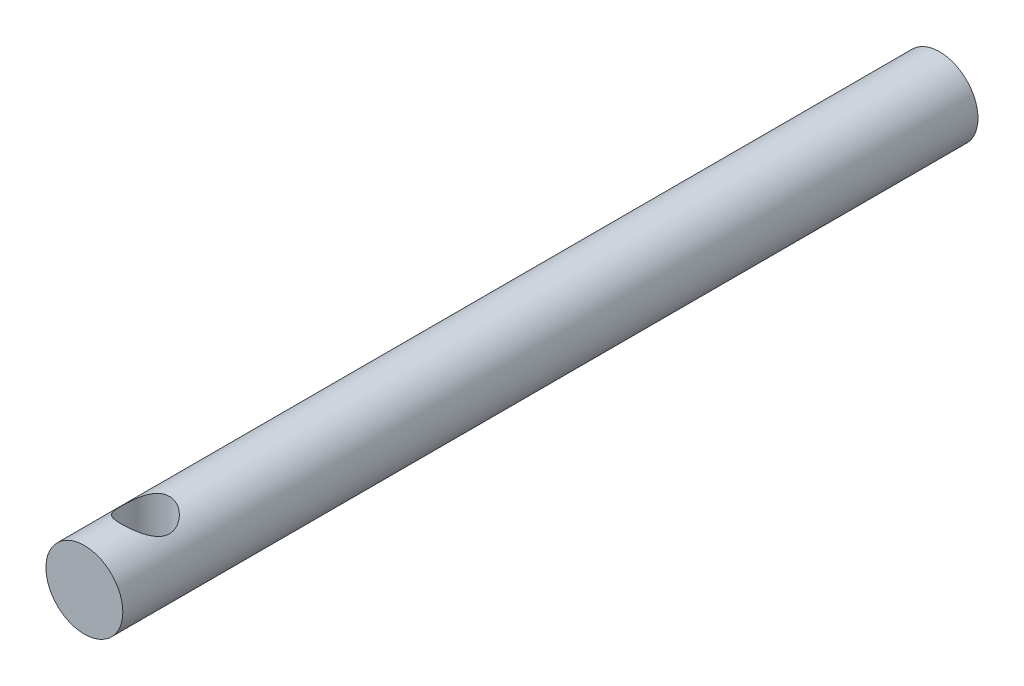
SolidWorks part; units mm, degrees
ref_plane "Front Plane" through (0, 0, 0) normal (0, 0, 1) x (1, 0, 0)
ref_plane "Top Plane" through (0, 0, 0) normal (0, 1, 0) x (1, 0, 0)
ref_plane "Right Plane" through (0, 0, 0) normal (1, 0, 0) x (0, 0, -1)
sketch "Sketch1" plane through (0, 0, 0) normal (0, 0, 1) x (1, 0, 0)
  circle A0 centre (0, 0) radius 4
  dimension "D1" = 8
extrude "Boss-Extrude1" add sketch "Sketch1" along normal blind 89
sketch "Sketch2" plane through (0, 0, 0) normal (0, 1, 0) x (1, 0, 0)
  circle A0 centre (0, -82.65) radius 2.5
  dimension "D1" = 5
  dimension "D2" = 6.35
extrude "Cut-Extrude1" cut sketch "Sketch2" against normal mid plane 89
hole_wizard "Ø6.0mm Dowel Hole1" positions "Sketch14" profile "Sketch16" hole size "Ø6.0" standard "ANSI Metric"
sketch "Sketch14" plane through (0, 0, 0) normal (0, 0, -1) x (-1, 0, 0)
  point P0 (0, 0)
sketch "Sketch16" plane through (0, 0, 0) normal (1, 0, 0) x (0, 1, 0)
  line L0 (0, 0) -> (0, 31.8026)
  line L1 (0, 31.8026) -> (3, 30)
  line L2 (3, 30) -> (3, 0)
  line L5 (3, 0) -> (0, 0)
  line L10 (0, 31.8026) -> (-3, 30) construction
  line L11 (0, -6.35) -> (0, 107.95) construction
  dimension "Hole Dia." = 6
  dimension "Hole Depth" = 30
  dimension "Drill Angle" = 118
